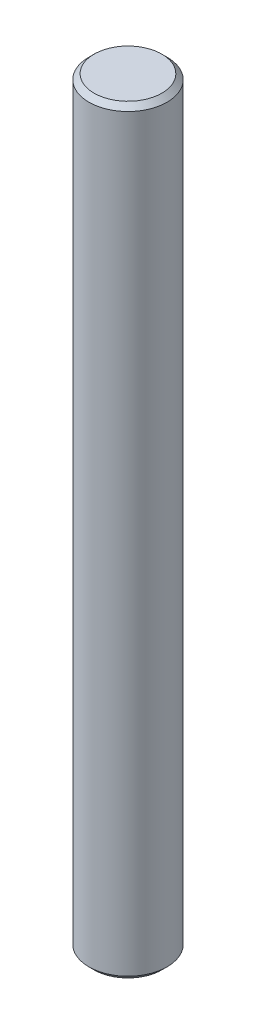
SolidWorks part; units mm, degrees
ref_plane "Спереди" through (0, 0, 0) normal (0, 0, 1) x (1, 0, 0)
ref_plane "Сверху" through (0, 0, 0) normal (0, 1, 0) x (1, 0, 0)
ref_plane "Справа" through (0, 0, 0) normal (1, 0, 0) x (0, 0, -1)
sketch "Эскиз2" plane through (0, 0, 0) normal (0, 1, 0) x (1, 0, 0)
  circle A0 centre (0, 0) radius 0.75
  dimension "D1" = 1.5
extrude "Бобышка-Вытянуть1" add sketch "Эскиз2" along normal mid plane 14.575
chamfer "Фаска1" distance 0.1 angle 45 2 edges at (0, -7.2875, 0.75) (0, 7.2875, 0.75)
